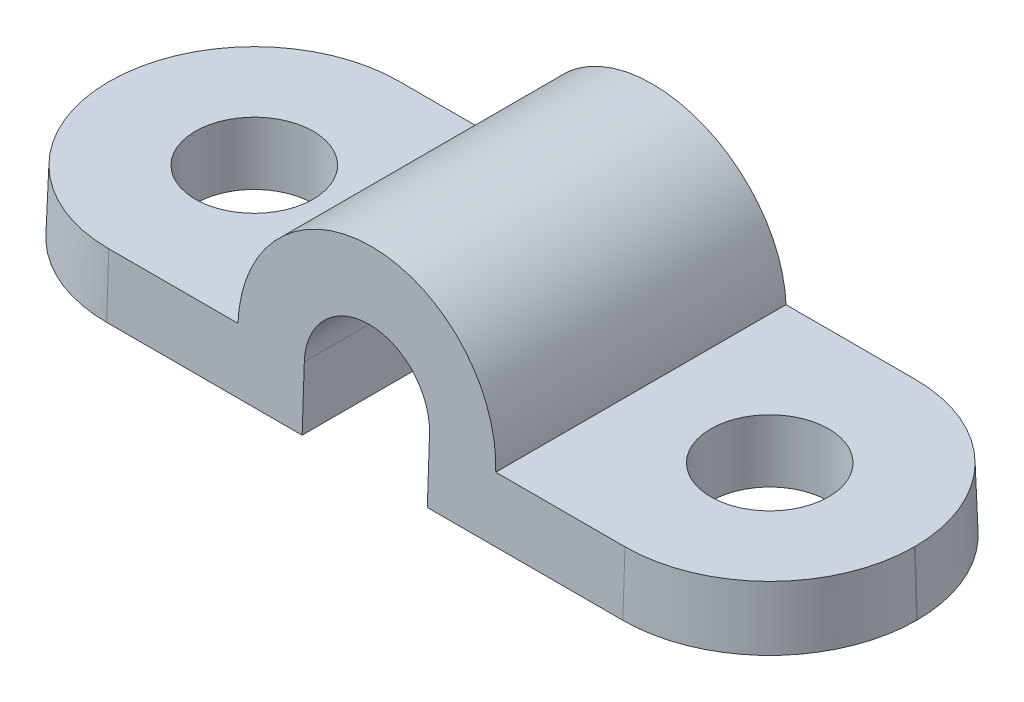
SolidWorks part; units mm, degrees
ref_plane "Face" through (0, 0, 0) normal (0, 0, 1) x (1, 0, 0)
ref_plane "Dessus" through (0, 0, 0) normal (0, 1, 0) x (1, 0, 0)
ref_plane "Droite" through (0, 0, 0) normal (1, 0, 0) x (0, 0, -1)
sketch "Esquisse1" plane through (0, 0, 0) normal (0, 0, 1) x (1, 0, 0)
  line L0 (-13.6618, 0) -> (13.1474, 0) construction
  line L1 (-13.6618, 1.7) -> (11.6451, 1.7) construction
  line L2 (0, 6.9334) -> (0, -5.8356) construction
  line L3 (7, 5.3734) -> (7, -3.4089) construction
  line L4 (11, 2.8311) -> (11, -2.6) construction
  line L5 (-11, 3.64) -> (-11, -1.8489) construction
  line L6 (-1.7, 6.9334) -> (-1.7, -6.2978) construction
  line L7 (-11, 1.7) -> (-3.5, 1.7)
  line L8 (-11, 1.7) -> (-11, 0)
  line L9 (-11, 0) -> (-1.7, 0)
  line L10 (11, 1.7) -> (11, 0)
  line L11 (1.7, 6.9334) -> (1.7, -5.8356) construction
  line L12 (1.7, 0) -> (11, 0)
  line L13 (3.5, 1.7) -> (11, 1.7)
  line L14 (1.7, 1.7) -> (1.7, 0)
  line L15 (-1.7, 1.7) -> (-1.7, 0)
  arc A0 (1.7, 1.7) -> (-1.7, 1.7) centre (0, 1.7) ccw
  arc A1 (3.5, 1.7) -> (-3.5, 1.7) centre (0, 1.7) ccw
extrude "Base-Extrusion" add sketch "Esquisse1" along normal mid plane 8
sketch "Esquisse2" plane through (0, 0, 0) normal (0, 1, 0) x (1, 0, 0)
  line L0 (-11.5357, 0) -> (11.7319, 0) construction
  line L1 (7, 4.6094) -> (7, -5.9824) construction
  line L2 (0, 5.3694) -> (0, -7.6251) construction
  circle A0 centre (7, 0) radius 1.6
  circle A1 centre (-7, 0) radius 1.6
extrude "Enlèv. mat.-Extru.7" cut sketch "Esquisse2" along normal through all
fillet "Congé1" radius 3.99
draft "Dépouille6" type of draft neutral plane draft angle 2 faces to draft 8 parameters "D1"=2
